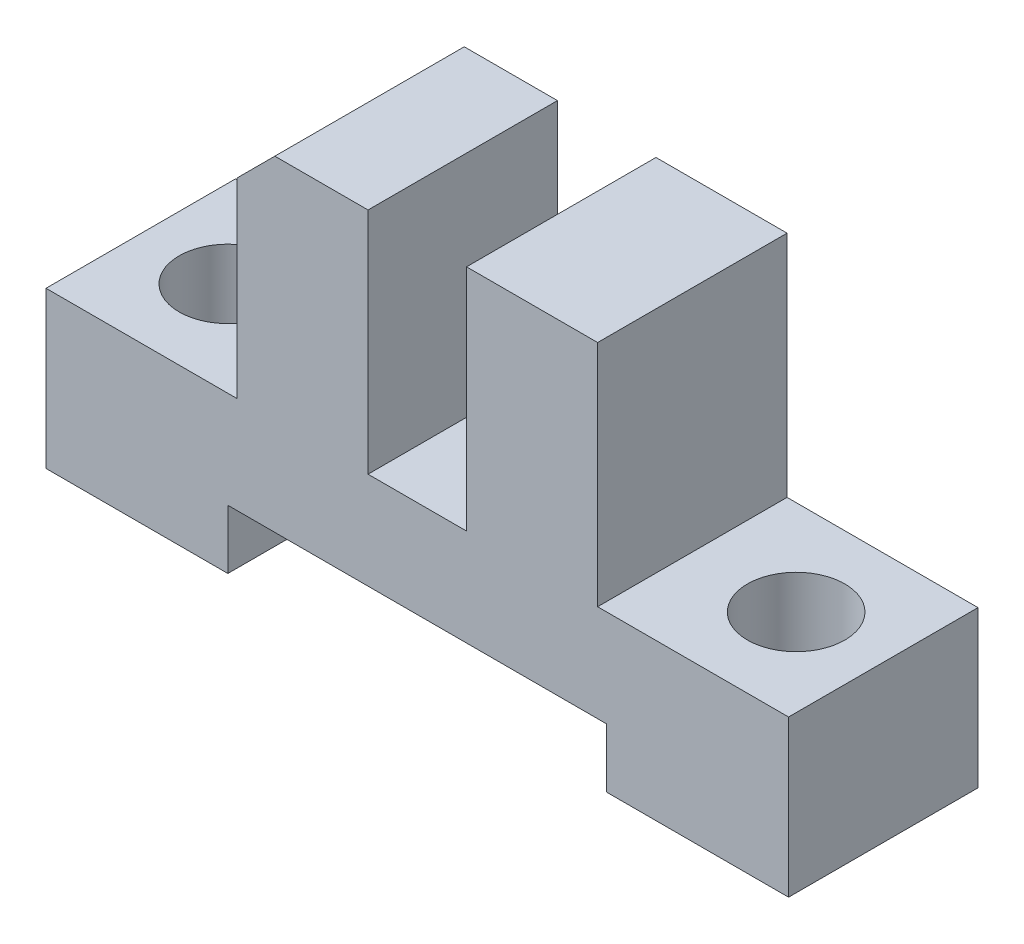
SolidWorks part; units mm, degrees
ref_plane "Front" through (0, 0, 0) normal (0, 0, 1) x (1, 0, 0)
ref_plane "Top" through (0, 0, 0) normal (0, 1, 0) x (1, 0, 0)
ref_plane "Right" through (0, 0, 0) normal (1, 0, 0) x (0, 0, -1)
sketch "Sketch1" plane through (0, 0, 0) normal (0, 0, 1) x (1, 0, 0)
  line L0 (1.651, 12.9032) -> (1.651, 5.2324)
  line L1 (-6.0452, 12.9032) -> (-1.651, 12.9032)
  line L2 (-6.0452, 12.9032) -> (-6.0452, 5.2324)
  line L3 (-12.446, 0) -> (-6.35, 0)
  line L4 (6.0452, 12.9032) -> (6.0452, 5.2324)
  line L5 (1.651, 5.2324) -> (-1.651, 5.2324)
  line L6 (-1.651, 5.2324) -> (-1.651, 12.9032)
  line L7 (1.651, 12.9032) -> (6.0452, 12.9032)
  line L8 (-12.446, 5.2324) -> (-6.0452, 5.2324)
  line L9 (6.0452, 5.2324) -> (12.446, 5.2324)
  line L10 (12.446, 0) -> (12.446, 5.2324)
  line L11 (-12.446, 0) -> (-12.446, 5.2324)
  line L12 (-6.35, 0) -> (-6.35, 1.9812)
  line L13 (-6.35, 1.9812) -> (6.35, 1.9812)
  line L14 (6.35, 1.9812) -> (6.35, 0)
  line L15 (6.35, 0) -> (12.446, 0)
  point P9 (0, 5.2324)
  point P18 (0, 1.9812)
  dimension "D1" = 24.892
  dimension "D2" = 12.9032
  dimension "D3" = 5.2324
  dimension "D4" = 12.0904
  dimension "D5" = 3.302
  dimension "D6" = 10.922
  dimension "D7" = 6.096
extrude "Extrude1" add sketch "Sketch1" along normal blind 6.35
chamfer "Chamfer1" distance 1.27 angle 45
hole_wizard "#30 (0.128500) Diameter Hole1" positions "Sketch3" profile "Sketch2" hole size "#30" standard "Ansi Inch"
sketch "Sketch3" plane through (0, 5.2324, 0) normal (0, 1, 0) x (-1, 0, 0)
  line L0 (-12.446, 0) -> (-6.0452, 0) construction
  point P0 (9.525, 3.175)
  point P1 (-9.525, 3.175)
  dimension "D1" = 3.175
  dimension "D2" = 19.05
  dimension "D3" = 9.525
sketch "Sketch2" plane through (-9.525, 5.2324, 3.175) normal (1, 0, 0) x (0, 0, 1)
  line L0 (0, 0) -> (0, 5.2324)
  line L1 (0, 5.2324) -> (1.6319, 5.2324)
  line L2 (1.6319, 5.2324) -> (1.6319, 0)
  line L5 (1.6319, 0) -> (0, 0)
  line L11 (0, -6.35) -> (0, 107.95) construction
  dimension "Thru Hole Dia." = 3.2639
  dimension "Thru Hole Depth" = 5.2324
ref_plane "center" through (0, 0, 3.175) normal (0, 0, 1) x (1, 0, 0)
